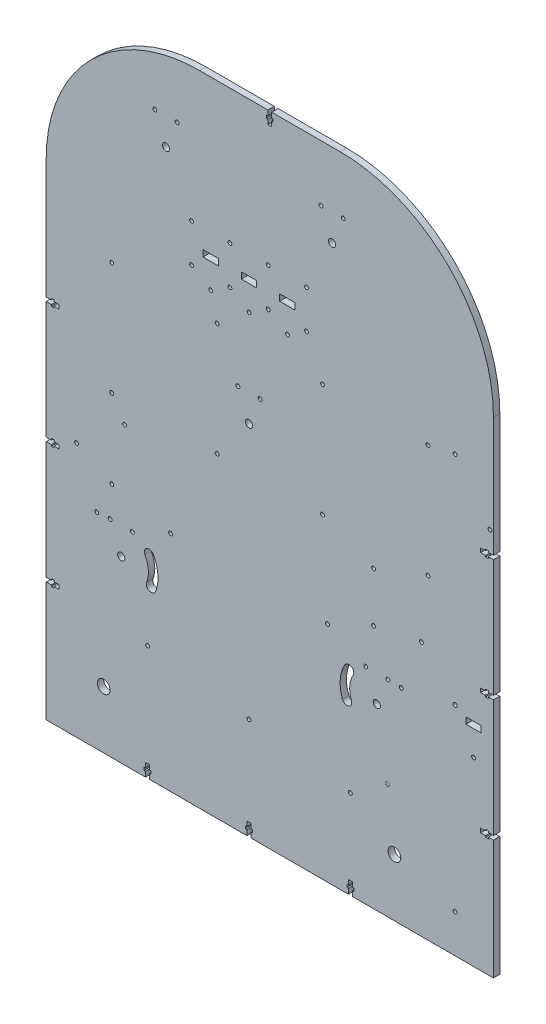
SolidWorks part; units mm, degrees
ref_plane "Front Plane" through (0, 0, 0) normal (0, 0, 1) x (1, 0, 0)
ref_plane "Top Plane" through (0, 0, 0) normal (0, 1, 0) x (1, 0, 0)
ref_plane "Right Plane" through (0, 0, 0) normal (1, 0, 0) x (0, 0, -1)
ref_plane "Plane1" through (0, 0, 5) normal (0, 0, 1) x (1, 0, 0)
sketch "Sketch1" plane through (0, 0, 5) normal (0, 0, 1) x (1, 0, 0)
  line L0 (168.8, -57.15) -> (171, -57.15)
  line L1 (171, -57.15) -> (171, -58.5)
  line L2 (171, -58.5) -> (175, -58.5)
  line L3 (175, -58.5) -> (175, 33.5)
  line L4 (175, 33.5) -> (171, 33.5)
  line L5 (171, 33.5) -> (171, 32.15)
  line L6 (171, 32.15) -> (168.8, 32.15)
  line L7 (168.8, 32.15) -> (168.8, 33.3)
  line L8 (168.8, 33.3) -> (165, 33.3)
  line L9 (165, 33.3) -> (165, 36.5)
  line L10 (165, 36.5) -> (168.8, 36.5)
  line L11 (168.8, 36.5) -> (168.8, 37.65)
  line L12 (168.8, 37.65) -> (171, 37.65)
  line L13 (171, 37.65) -> (171, 36.5)
  line L14 (171, 36.5) -> (175, 36.5)
  line L15 (175, 36.5) -> (175, 130)
  line L16 (55, 250) -> (1.5, 250)
  line L17 (1.5, 250) -> (1.5, 246)
  line L18 (1.5, 246) -> (2.65, 246)
  line L19 (2.65, 246) -> (2.65, 243.8)
  line L20 (2.65, 243.8) -> (1.5, 243.8)
  line L21 (1.5, 243.8) -> (1.5, 240)
  line L22 (1.5, 240) -> (-1.5, 240)
  line L23 (-1.5, 240) -> (-1.5, 243.8)
  line L24 (-1.5, 243.8) -> (-2.65, 243.8)
  line L25 (-2.65, 243.8) -> (-2.65, 246)
  line L26 (-2.65, 246) -> (-1.5, 246)
  line L27 (-1.5, 246) -> (-1.5, 250)
  line L28 (-1.5, 250) -> (-55, 250)
  line L29 (-175, 130) -> (-175, 36.5)
  line L30 (-175, 36.5) -> (-171, 36.5)
  line L31 (-171, 36.5) -> (-171, 37.65)
  line L32 (-171, 37.65) -> (-168.8, 37.65)
  line L33 (-168.8, 37.65) -> (-168.8, 36.5)
  line L34 (-168.8, 36.5) -> (-165, 36.5)
  line L35 (-165, 36.5) -> (-165, 33.3)
  line L36 (-165, 33.3) -> (-168.8, 33.3)
  line L37 (-168.8, 33.3) -> (-168.8, 32.15)
  line L38 (-168.8, 32.15) -> (-171, 32.15)
  line L39 (-171, 32.15) -> (-171, 33.5)
  line L40 (-171, 33.5) -> (-175, 33.5)
  line L41 (-175, 33.5) -> (-175, -58.5)
  line L42 (-175, -58.5) -> (-171, -58.5)
  line L43 (-171, -58.5) -> (-171, -57.15)
  line L44 (-171, -57.15) -> (-168.8, -57.15)
  line L45 (-168.8, -57.15) -> (-168.8, -58.5)
  line L46 (-168.8, -58.5) -> (-165, -58.5)
  line L47 (-165, -58.5) -> (-165, -61.5)
  line L48 (-165, -61.5) -> (-168.8, -61.5)
  line L49 (-168.8, -61.5) -> (-168.8, -62.65)
  line L50 (-168.8, -62.65) -> (-171, -62.65)
  line L51 (-171, -62.65) -> (-171, -61.5)
  line L52 (-171, -61.5) -> (-175, -61.5)
  line L53 (-175, -61.5) -> (-175, -153.4)
  line L54 (-175, -153.4) -> (-171, -153.4)
  line L55 (-171, -153.4) -> (-171, -152.25)
  line L56 (-171, -152.25) -> (-168.8, -152.25)
  line L57 (-168.8, -152.25) -> (-168.8, -153.4)
  line L58 (-168.8, -153.4) -> (-165, -153.4)
  line L59 (-165, -153.4) -> (-165, -156.6)
  line L60 (-165, -156.6) -> (-168.8, -156.6)
  line L61 (-168.8, -156.6) -> (-168.8, -157.75)
  line L62 (-168.8, -157.75) -> (-171, -157.75)
  line L63 (-171, -157.75) -> (-171, -156.6)
  line L64 (-171, -156.6) -> (-175, -156.6)
  line L65 (-175, -156.6) -> (-175, -250)
  line L66 (-175, -250) -> (-97.225, -250)
  line L67 (-97.225, -250) -> (-97.225, -246)
  line L68 (-97.225, -246) -> (-98.375, -246)
  line L69 (-98.375, -246) -> (-98.375, -243.8)
  line L70 (-98.375, -243.8) -> (-97.225, -243.8)
  line L71 (-97.225, -243.8) -> (-97.225, -240)
  line L72 (-97.225, -240) -> (-94.025, -240)
  line L73 (-94.025, -240) -> (-94.025, -243.8)
  line L74 (-94.025, -243.8) -> (-92.875, -243.8)
  line L75 (-92.875, -243.8) -> (-92.875, -246)
  line L76 (-92.875, -246) -> (-94.025, -246)
  line L77 (-94.025, -246) -> (-94.025, -250)
  line L78 (-94.025, -250) -> (-17.85, -250)
  line L79 (-17.85, -250) -> (-17.85, -246)
  line L80 (-17.85, -246) -> (-19, -246)
  line L81 (-19, -246) -> (-19, -243.8)
  line L82 (-19, -243.8) -> (-17.85, -243.8)
  line L83 (-17.85, -243.8) -> (-17.85, -240)
  line L84 (-17.85, -240) -> (-14.65, -240)
  line L85 (-14.65, -240) -> (-14.65, -243.8)
  line L86 (-14.65, -243.8) -> (-13.5, -243.8)
  line L87 (-13.5, -243.8) -> (-13.5, -246)
  line L88 (-13.5, -246) -> (-14.65, -246)
  line L89 (-14.65, -246) -> (-14.65, -250)
  line L90 (-14.65, -250) -> (61.525, -250)
  line L91 (61.525, -250) -> (61.525, -246)
  line L92 (61.525, -246) -> (60.375, -246)
  line L93 (60.375, -246) -> (60.375, -243.8)
  line L94 (60.375, -243.8) -> (61.525, -243.8)
  line L95 (61.525, -243.8) -> (61.525, -240)
  line L96 (61.525, -240) -> (64.725, -240)
  line L97 (64.725, -240) -> (64.725, -243.8)
  line L98 (64.725, -243.8) -> (65.875, -243.8)
  line L99 (65.875, -243.8) -> (65.875, -246)
  line L100 (65.875, -246) -> (64.725, -246)
  line L101 (64.725, -246) -> (64.725, -250)
  line L102 (64.725, -250) -> (175, -250)
  line L103 (175, -250) -> (175, -156.6)
  line L104 (175, -156.6) -> (171, -156.6)
  line L105 (171, -156.6) -> (171, -157.75)
  line L106 (171, -157.75) -> (168.8, -157.75)
  line L107 (168.8, -157.75) -> (168.8, -156.6)
  line L108 (168.8, -156.6) -> (165, -156.6)
  line L109 (165, -156.6) -> (165, -153.4)
  line L110 (165, -153.4) -> (168.8, -153.4)
  line L111 (168.8, -153.4) -> (168.8, -152.25)
  line L112 (168.8, -152.25) -> (171, -152.25)
  line L113 (171, -152.25) -> (171, -153.4)
  line L114 (171, -153.4) -> (175, -153.4)
  line L115 (175, -153.4) -> (175, -61.5)
  line L116 (175, -61.5) -> (171, -61.5)
  line L117 (171, -61.5) -> (171, -62.65)
  line L118 (171, -62.65) -> (168.8, -62.65)
  line L119 (168.8, -62.65) -> (168.8, -61.5)
  line L120 (168.8, -61.5) -> (165, -61.5)
  line L121 (165, -61.5) -> (165, -58.5)
  line L122 (165, -58.5) -> (168.8, -58.5)
  line L123 (168.8, -58.5) -> (168.8, -57.15)
  arc A0 (65.2198, -99.5984) -> (63.8709, -117.509) centre (83.75, -110) ccw
  arc A1 (63.8709, -117.509) -> (56.8683, -120.1945) centre (60.3629, -118.8341) cw
  arc A2 (56.8683, -120.1945) -> (58.6614, -95.9603) centre (83.75, -110) cw
  arc A3 (58.6614, -95.9603) -> (65.2198, -99.5984) centre (61.9497, -97.7629) cw
  circle A4 centre (-123.6881, -64.6032) radius 1.5
  circle A5 centre (-96.4989, -77.2817) radius 1.5
  circle A6 centre (91.1881, -19.6032) radius 1.5
  circle A7 centre (91.1881, -64.6032) radius 1.5
  circle A8 centre (63.9989, -77.2817) radius 1.5
  circle A9 centre (-123.6881, -19.6032) radius 1.5
  circle A10 centre (48.75, 185) radius 2.8
  circle A11 centre (-16.25, 30) radius 2.8
  circle A12 centre (-81.25, 185) radius 2.8
  circle A13 centre (-116.25, -110) radius 2.8
  circle A14 centre (83.75, -110) radius 2.8
  arc A15 (-89.3683, -120.1945) -> (-96.3709, -117.509) centre (-92.8629, -118.8341) cw
  arc A16 (-96.3709, -117.509) -> (-97.7198, -99.5984) centre (-116.25, -110) ccw
  arc A17 (-97.7198, -99.5984) -> (-91.1614, -95.9603) centre (-94.4497, -97.7629) cw
  arc A18 (-91.1614, -95.9603) -> (-89.3683, -120.1945) centre (-116.25, -110) cw
  circle A19 centre (-130, -205) radius 5
  circle A20 centre (97.5, -205) radius 5
  circle A21 centre (172.25, 52.5) radius 1.5
  circle A22 centre (118.6881, -50.5299) radius 1.5
  circle A23 centre (102.8765, -89.4957) radius 1.5
  circle A24 centre (-151.1881, -50.5299) radius 1.5
  circle A25 centre (-135.3765, -89.4957) radius 1.5
  arc A26 (175, 130) -> (55, 250) centre (55, 130) ccw
  arc A27 (-55, 250) -> (-175, 130) centre (-55, 130) ccw
  circle A28 centre (-1.25, 145) radius 1.5
  circle A29 centre (28.75, 115) radius 1.5
  circle A30 centre (-1.25, 115) radius 1.5
  circle A31 centre (-31.25, 115) radius 1.5
  circle A32 centre (-61.25, 115) radius 1.5
  circle A33 centre (-61.25, 145) radius 1.5
  circle A34 centre (-31.25, 145) radius 1.5
  circle A35 centre (28.75, 145) radius 1.5
  circle A36 centre (145, -113) radius 1.5
  circle A37 centre (145, -54) radius 1.5
  circle A38 centre (145, 5) radius 1.5
  circle A39 centre (145, -220) radius 1.5
extrude "Boss-Extrude1" add sketch "Sketch1" against normal blind 5
sketch "Sketch2" plane through (0, 0, 5) normal (0, 0, 1) x (1, 0, 0)
  line L0 (-61.25, 145) -> (28.75, 145) construction
  line L1 (28.75, 145) -> (28.75, 115) construction
  line L2 (28.75, 115) -> (-61.25, 115) construction
sketch "Sketch4" plane through (0, 0, 5) normal (0, 0, 1) x (1, 0, 0)
  line L0 (-61.25, 145) -> (-61.25, 115) construction
  line L1 (-61.25, 115) -> (-61.25, 130) construction
  line L2 (-61.25, 130) -> (28.75, 130) construction
  line L3 (28.75, 145) -> (28.75, 115) construction
sketch "Sketch5" plane through (0, 0, 0) normal (0, 0, 1) x (1, 0, 0)
  line L0 (-24.95, 51.1) -> (-7.55, 51.1) construction
  line L1 (-7.55, 51.1) -> (-16.25, 30) construction
  line L2 (-16.25, 30) -> (-24.95, 51.1) construction
  line L3 (-124.95, -88.9) -> (-107.55, -88.9) construction
  line L4 (-107.55, -88.9) -> (-116.25, -110) construction
  line L5 (-116.25, -110) -> (-124.95, -88.9) construction
  line L6 (75.05, -88.9) -> (92.45, -88.9) construction
  line L7 (92.45, -88.9) -> (83.75, -110) construction
  line L8 (83.75, -110) -> (75.05, -88.9) construction
  line L9 (40.05, 206.1) -> (57.45, 206.1) construction
  line L10 (57.45, 206.1) -> (48.75, 185) construction
  line L11 (48.75, 185) -> (40.05, 206.1) construction
  line L12 (-89.95, 206.1) -> (-72.55, 206.1) construction
  line L13 (-72.55, 206.1) -> (-81.25, 185) construction
  line L14 (-81.25, 185) -> (-89.95, 206.1) construction
  circle A0 centre (-81.25, 185) radius 2.8
  circle A1 centre (-81.25, 185) radius 2.8
  circle A2 centre (48.75, 185) radius 2.8
  circle A3 centre (48.75, 185) radius 2.8 construction
  circle A4 centre (-16.25, 30) radius 2.8
  circle A5 centre (-16.25, 30) radius 2.8 construction
  circle A6 centre (-130, -205) radius 5
  circle A7 centre (-130, -205) radius 5 construction
  circle A8 centre (97.5, -205) radius 5
  circle A9 centre (97.5, -205) radius 5 construction
  circle A10 centre (83.75, -110) radius 2.8
  circle A11 centre (83.75, -110) radius 2.8
  circle A12 centre (-116.25, -110) radius 2.8
  circle A13 centre (-116.25, -110) radius 2.8 construction
  circle A15 centre (92.45, -88.9) radius 1.5
  circle A16 centre (75.05, -88.9) radius 1.5
  circle A17 centre (-107.55, -88.9) radius 1.5
  circle A18 centre (-124.95, -88.9) radius 1.5
  circle A19 centre (-7.55, 51.1) radius 1.5
  circle A20 centre (-24.95, 51.1) radius 1.5
  circle A21 centre (-89.95, 206.1) radius 1.5
  circle A22 centre (-72.55, 206.1) radius 1.5
  circle A23 centre (40.05, 206.1) radius 1.5
  circle A24 centre (57.45, 206.1) radius 1.5
  dimension "D1" = 3
  dimension "D2" = 3
  dimension "D3" = 3
  dimension "D4" = 3
  dimension "D5" = 3
  dimension "D6" = 3
  dimension "D7" = 3
  dimension "D8" = 3
  dimension "D9" = 3
  dimension "D10" = 3
extrude "Cut-Extrude5" cut sketch "Sketch5" along normal through all contours A15 | A16 | A22 | A21 | A24 | A23 | A17 | A18 | A19 | A20
sketch "Sketch11" plane through (0, 0, 0) normal (0, 0, -1) x (-1, 0, 0)
  line L0 (1.25, 145) -> (1.25, 115) construction
  line L1 (-28.75, 115) -> (61.25, 115) construction
  line L2 (10.25, 145) -> (10.25, 115) construction
  line L3 (-19.75, 145) -> (-19.75, 115) construction
  line L4 (61.25, 145) -> (-28.75, 145) construction
  line L5 (-28.75, 145) -> (-28.75, 115) construction
  line L6 (-19.75, 130) -> (-7.75, 130)
  line L7 (-19.75, 130) -> (-19.75, 125)
  line L8 (-19.75, 125) -> (-7.75, 125)
  line L9 (-7.75, 130) -> (-7.75, 125)
  line L10 (52.25, 145) -> (52.25, 115) construction
  line L12 (61.25, 145) -> (61.25, 115) construction
  line L14 (10.25, 130) -> (22.25, 130)
  line L15 (10.25, 130) -> (10.25, 125)
  line L16 (10.25, 125) -> (22.25, 125)
  line L17 (22.25, 130) -> (22.25, 125)
  line L18 (52.25, 130) -> (40.25, 130)
  line L19 (52.25, 130) -> (52.25, 125)
  line L20 (52.25, 125) -> (40.25, 125)
  line L21 (40.25, 130) -> (40.25, 125)
  dimension "D1" = 9
  dimension "D2" = 5
  dimension "D3" = 12
  dimension "D4" = 9
  dimension "D5" = 9
  dimension "D6" = 12
  dimension "D7" = 12
extrude "Cut-Extrude6" cut sketch "Sketch11" against normal through all contours L8 L9 L6 L7 | L20 L21 L18 L19 | L16 L17 L14 L15
sketch "Sketch15" plane through (0, 0, 0) normal (0, 0, -1) x (-1, 0, 0)
  line L0 (-13.75, 125) -> (-13.75, 105.5) construction
  line L1 (-19.75, 125) -> (-7.75, 125) construction
  line L2 (16.25, 125) -> (16.25, 105.5) construction
  line L3 (10.25, 125) -> (22.25, 125) construction
  line L4 (46.25, 125) -> (46.25, 105.5) construction
  line L5 (52.25, 125) -> (40.25, 125) construction
  circle A0 centre (-13.75, 105.5) radius 1.5
  circle A1 centre (16.25, 105.5) radius 1.5
  circle A2 centre (46.25, 105.5) radius 1.5
  dimension "D4" = 3
  dimension "D5" = 3
  dimension "D6" = 3
  dimension "D1" = 19.5
  dimension "D2" = 19.5
  dimension "D3" = 19.5
extrude "Cut-Extrude9" cut sketch "Sketch15" against normal blind 10
sketch "Sketch21" plane through (0, 0, 5) normal (0, 0, 1) x (1, 0, 0)
  line L0 (91.1881, -19.6032) -> (91.1881, -64.6032) construction
  line L1 (91.1881, -64.6032) -> (63.9989, -77.2817) construction
  line L2 (81.1881, -19.3521) -> (81.1881, -58.2325) construction
  line L3 (81.1881, -58.2325) -> (45.1499, -75.0374) construction
  line L4 (-116.25, -110) -> (83.75, -110) construction
  line L5 (-16.25, -110) -> (-16.25, 9.4091) construction
  circle A0 centre (63.9989, -77.2817) radius 1.5 construction
  circle A1 centre (91.1881, -64.6032) radius 1.5
  circle A2 centre (91.1881, -19.6032) radius 1.5
  circle A3 centre (63.9989, -77.2817) radius 1.5
  circle A4 centre (91.1881, -64.6032) radius 1.5 construction
  circle A5 centre (91.1881, -19.6032) radius 1.5 construction
  circle A6 centre (81.1881, -19.3521) radius 1.5
  circle A7 centre (81.1881, -58.2325) radius 1.5
  circle A8 centre (45.1499, -75.0374) radius 1.5
  circle A9 centre (-123.6881, -19.6032) radius 1.5
  circle A10 centre (-123.6881, -64.6032) radius 1.5
  circle A11 centre (-96.4989, -77.2817) radius 1.5
  circle A12 centre (-77.6499, -75.0374) radius 1.5
  circle A13 centre (-113.6881, -58.2325) radius 1.5
  circle A14 centre (-113.6881, -19.3521) radius 1.5
  dimension "D1" = 10
  dimension "D2" = 10
extrude "Cut-Extrude10" cut sketch "Sketch21" against normal blind 5 contours A8 | A7 | A6 | A12 | A13 | A14
sketch "Sketch23" plane through (0, 0, 5) normal (0, 0, 1) x (1, 0, 0)
  circle A0 centre (91.1881, -19.6032) radius 1.5
  circle A1 centre (91.1881, -64.6032) radius 1.5
  circle A2 centre (63.9989, -77.2817) radius 1.5
  circle A3 centre (-123.6881, -19.6032) radius 1.5
  circle A4 centre (-113.6881, -58.2325) radius 1.5
  circle A5 centre (-96.4989, -77.2817) radius 1.5
extrude "Boss-Extrude6" add sketch "Sketch23" against normal blind 5
sketch "Sketch24" plane through (0, 0, 0) normal (0, 0, -1) x (1, 0, 0)
  line L1 (153.4587, 181.8822) -> (165.4587, 181.8822)
  line L2 (153.4587, 181.8822) -> (153.4587, 186.8822)
  line L3 (153.4587, 186.8822) -> (165.4587, 186.8822)
  line L4 (165.4587, 181.8822) -> (165.4587, 186.8822)
  circle A0 centre (159.4372, 206.3822) radius 1.5
  dimension "D1" = 12
  dimension "D2" = 5
extrude "Cut-Extrude11" cut sketch "Sketch24" against normal blind 5 contours L3 L4 L1 L2 | A0
sketch "Sketch27" plane through (0, 0, 0) normal (0, 0, -1) x (-1, 0, 0)
  line L0 (-38.7495, -1.3509) -> (-43.75, -1.3509) construction
  line L1 (-43.75, -1.3509) -> (-43.75, 83.9813) construction
  line L2 (-43.75, 83.9813) -> (-38.75, 83.9813) construction
  line L3 (-38.75, 86.9813) -> (-43.75, 86.9813) construction
  line L4 (-43.75, 86.9813) -> (-43.75, 133.5144) construction
  line L5 (-43.75, 133.5144) -> (-38.75, 133.5144) construction
  line L6 (-175, 95.9782) -> (175, 95.9782) construction
  line L7 (-175, 36.5) -> (-175, 130) construction
  line L8 (175, 130) -> (175, 36.5) construction
  line L9 (0, 100.8536) -> (0, 70.9738) construction
  line L10 (38.7495, -1.3509) -> (43.75, -1.3509) construction
  line L11 (38.75, 86.9813) -> (43.75, 86.9813) construction
  line L12 (43.75, -1.3509) -> (43.75, 83.9813) construction
  line L13 (43.75, 83.9813) -> (38.75, 83.9813) construction
  line L14 (43.75, 133.5144) -> (38.75, 133.5144) construction
  line L15 (43.75, 86.9813) -> (43.75, 133.5144) construction
  line L16 (-82.5, 109.8627) -> (-82.5, 63.5183) construction
  line L17 (-126.2505, -1.3509) -> (-121.25, -1.3509) construction
  line L18 (-121.25, -1.3509) -> (-121.25, 83.9813) construction
  line L19 (-121.25, 83.9813) -> (-126.25, 83.9813) construction
  line L20 (-126.25, 86.9813) -> (-121.25, 86.9813) construction
  line L21 (-121.25, 86.9813) -> (-121.25, 133.5144) construction
  line L22 (-121.25, 133.5144) -> (-126.25, 133.5144) construction
  line L23 (82.5, 125.3077) -> (82.5, 63.5183) construction
  line L24 (126.2505, -1.3509) -> (121.25, -1.3509) construction
  line L25 (126.25, 86.9813) -> (121.25, 86.9813) construction
  line L26 (121.25, 83.9813) -> (126.25, 83.9813) construction
  line L27 (121.25, -1.3509) -> (121.25, 83.9813) construction
  line L28 (121.25, 133.5144) -> (126.25, 133.5144) construction
  line L29 (121.25, 86.9813) -> (121.25, 133.5144) construction
  line L30 (-121.25, 83.9813) -> (-126.25, 86.9813) construction
  line L31 (-126.25, 86.9813) -> (-121.25, 86.9813) construction
  line L32 (-121.25, 86.9813) -> (-126.25, 83.9813) construction
  line L33 (-123.7503, -1.3509) -> (-123.7503, -2.8509) construction
  circle A0 centre (-123.75, 85.4813) radius 1.5
  circle A1 centre (-123.7503, -2.8509) radius 1.5
  circle A2 centre (-41.2497, -2.8509) radius 1.5
  circle A3 centre (-41.25, 85.4813) radius 1.5
  circle A4 centre (123.75, 85.4813) radius 1.5
  circle A5 centre (123.7503, -2.8509) radius 1.5
  circle A6 centre (41.2497, -2.8509) radius 1.5
  circle A7 centre (41.25, 85.4813) radius 1.5
  dimension "D1" = 43.75
  dimension "D2" = 82.5
  dimension "D3" = 82.5
extrude "Cut-Extrude12" cut sketch "Sketch27" against normal blind 10 contours A0 | A1 | A3 | A2 | A7 | A6 | A4 | A5
sketch "Sketch28" plane through (0, 0, 0) normal (0, 0, -1) x (-1, 0, 0)
  line L0 (-175, -250) -> (-168.8, -250) construction
  line L1 (-64.725, -250) -> (-175, -250) construction
  line L2 (-168.8, -250) -> (-168.8, -152.25) construction
  line L3 (-92.225, -161.605) -> (-92.0431, -160.1161) construction
  line L4 (175, -189.67) -> (137.5, -189.67) construction
  line L5 (175, -156.6) -> (175, -250) construction
  line L6 (175, -189.67) -> (175, -250) construction
  line L7 (-15.65, -170.96) -> (-15.65, -169.46) construction
  line L8 (-15.65, -170.96) -> (-168.8, -152.25) construction
  line L9 (-15.65, -170.96) -> (137.5, -189.67) construction
  line L10 (60.925, -180.315) -> (61.1069, -178.8261) construction
  circle A0 centre (-92.0431, -160.1161) radius 1.5
  circle A1 centre (-15.65, -169.46) radius 1.5
  circle A2 centre (61.1069, -178.8261) radius 1.5
sketch "Sketch20" plane through (0, 0, 0) normal (0, 0, -1) x (-1, 0, 0)
  circle A0 centre (123.6881, -64.6032) radius 1.4604
extrude "Cut-Extrude13" cut sketch "Sketch28" against normal blind 10
sketch "Sketch29" plane through (0, 0, 0) normal (0, 0, -1) x (-1, 0, 0)
  circle A0 centre (89.95, 206.1) radius 1.4853
  circle A1 centre (72.55, 206.1) radius 1.5
ref_plane "Plane2" through (-14.65, -250, 5) normal (1, 0, 0) x (0, 0, -1)
sketch "Sketch39" plane through (0, 0, 0) normal (0, 0, -1) x (-1, 0, 0)
  line L0 (175, -250) -> (175, -150)
  line L1 (175, -61.5) -> (175, -153.4) construction
  line L2 (-175, -250) -> (-137.5, -250)
  line L3 (-64.725, -250) -> (-175, -250) construction
  line L4 (-137.5, -250) -> (-137.5, -190)
  line L5 (-137.5, -190) -> (175, -150)
  line L6 (-92.0431, -160.1161) -> (61.1069, -178.8261)
  line L7 (-153.4587, -186.8822) -> (-165.4587, -186.8822)
  line L8 (-153.4587, -186.8822) -> (-153.4587, -181.8822)
  line L9 (-153.4587, -181.8822) -> (-165.4587, -181.8822)
  line L10 (-165.4587, -186.8822) -> (-165.4587, -181.8822)
  line L11 (-153.4587, -88.7637) -> (-165.4587, -88.7637)
  line L12 (-153.4587, -88.7637) -> (-153.4587, -83.7637)
  line L13 (-153.4587, -83.7637) -> (-165.4587, -83.7637)
  line L14 (-165.4587, -88.7637) -> (-165.4587, -83.7637)
  line L15 (61.1069, -178.8261) -> (175, -192.7401)
  line L16 (-92.0431, -160.1161) -> (-137.5445, -154.5573)
  circle A0 centre (-159.4372, -206.3822) radius 1.5
  circle A1 centre (-159.4587, -108.2637) radius 1.5
  circle A2 centre (61.1069, -178.8261) radius 1.5
  circle A3 centre (-15.65, -169.46) radius 1.5
  circle A4 centre (-92.0431, -160.1161) radius 1.4745
  circle A5 centre (95.6474, -160.1571) radius 1.5
  circle A6 centre (16.2948, -170.3143) radius 1.5
  circle A7 centre (-63.0578, -180.4714) radius 1.5
  circle A8 centre (-145, -113) radius 1.5
  circle A9 centre (-145, -54) radius 1.5
  circle A10 centre (-145, 5) radius 1.5
  circle A11 centre (-145, -80) radius 1.6182
  circle A12 centre (-145, 90) radius 1.5
  point P26 (-159.4587, -88.7637)
  point P27 (-165.4587, -86.2637)
  dimension "D3" = 22
  dimension "D4" = 80
  dimension "D7" = 170
  dimension "D1" = 37.5
  dimension "D2" = 60
  dimension "D5" = 80
  dimension "D6" = 80
  dimension "D8" = 170
extrude "Cut-Extrude16" cut sketch "Sketch39" against normal blind 5 contours L13 L14 L11 L12 | A11 | A1 | A12 | A7 | A6 | A5
sketch "Sketch40" plane through (0, 0, 0) normal (0, 0, -1) x (-1, 0, 0)
  line L0 (-153.4587, -186.8822) -> (-165.4587, -186.8822)
  line L1 (-153.4587, -186.8822) -> (-153.4587, -181.8822)
  line L2 (-153.4587, -181.8822) -> (-165.4587, -181.8822)
  line L3 (-165.4587, -186.8822) -> (-165.4587, -181.8822)
  line L4 (-165.4587, -181.8822) -> (-165.4587, -186.8822) construction
  line L5 (-153.4587, -181.8822) -> (-165.4587, -181.8822) construction
  line L6 (-153.4587, -186.8822) -> (-165.4587, -186.8822) construction
  circle A0 centre (-159.4372, -206.3822) radius 1.5
  circle A1 centre (61.1069, -178.8261) radius 1.5
  circle A2 centre (-15.65, -169.46) radius 1.5
  circle A3 centre (-92.0431, -160.1161) radius 1.4745
  circle A4 centre (-145, -113) radius 1.5
  circle A5 centre (-145, -54) radius 1.5
  circle A6 centre (-145, 5) radius 1.5
  circle A7 centre (-145, -113) radius 1.5 construction
  circle A8 centre (-145, 5) radius 1.5 construction
  circle A9 centre (-145, -54) radius 1.5 construction
  circle A10 centre (-159.4372, -206.3822) radius 1.5 construction
  circle A11 centre (-92.0431, -160.1161) radius 1.5 construction
  circle A12 centre (-15.65, -169.46) radius 1.5 construction
  circle A13 centre (61.1069, -178.8261) radius 1.5 construction
  point P18 (0, 0)
  point P25 (0, 0)
extrude "Boss-Extrude8" add sketch "Sketch40" against normal blind 5 contours L3 L0 L1 L2 | A1 | A2 | A3 | A5 | A6 | A4 | A0
